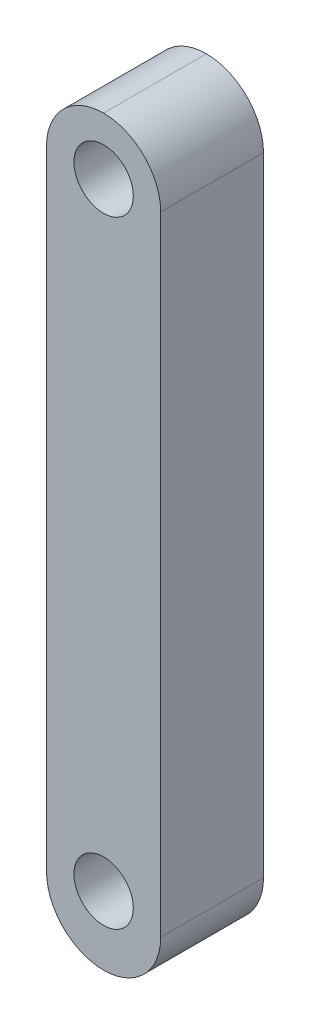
SolidWorks part; units mm, degrees
ref_plane "Ebene vorne" through (0, 0, 0) normal (0, 0, 1) x (1, 0, 0)
ref_plane "Ebene oben" through (0, 0, 0) normal (0, 1, 0) x (1, 0, 0)
ref_plane "Ebene rechts" through (0, 0, 0) normal (1, 0, 0) x (0, 0, -1)
sketch "Skizze1" plane through (0, 0, 0) normal (0, 0, 1) x (1, 0, 0)
  line L1 (-2.5, 16.25) -> (2.5, 16.25)
  line L2 (-2.5, 16.25) -> (-2.5, -16.25)
  line L3 (-2.5, -16.25) -> (2.5, -16.25)
  line L4 (2.5, 16.25) -> (2.5, -16.25)
  line L5 (-2.5, 16.25) -> (2.5, -16.25) construction
  line L6 (-2.5, -16.25) -> (2.5, 16.25) construction
  point P0 (0, 0)
  dimension "D1" = 5
  dimension "D2" = 32.5
extrude "Aufsatz-Linear austragen1" add sketch "Skizze1" along normal blind 4.5
fillet "Verrundung1" radius 2.5 2 edges at (2.5, 16.25, 2.25) (-2.5, 16.25, 2.25)
sketch "Skizze2" plane through (0, 0, 4.5) normal (0, 0, 1) x (1, 0, 0)
  circle A0 centre (0, 13.75) radius 1.3
  dimension "D1" = 2.6
extrude "Schnitt-Linear austragen1" cut sketch "Skizze2" against normal blind 4.5
sketch "Skizze3" plane through (0, 0, 4.5) normal (0, 0, 1) x (1, 0, 0)
  line L0 (-2.5, -16.25) -> (2.5, -16.25) construction
  circle A0 centre (0, -13.25) radius 1.3
  dimension "D1" = 2.6
  dimension "D2" = 3
extrude "Schnitt-Linear austragen2" cut sketch "Skizze3" against normal blind 20
fillet "Verrundung2" radius 2.5 2 edges at (-2.5, -16.25, 2.25) (2.5, -16.25, 2.25)
